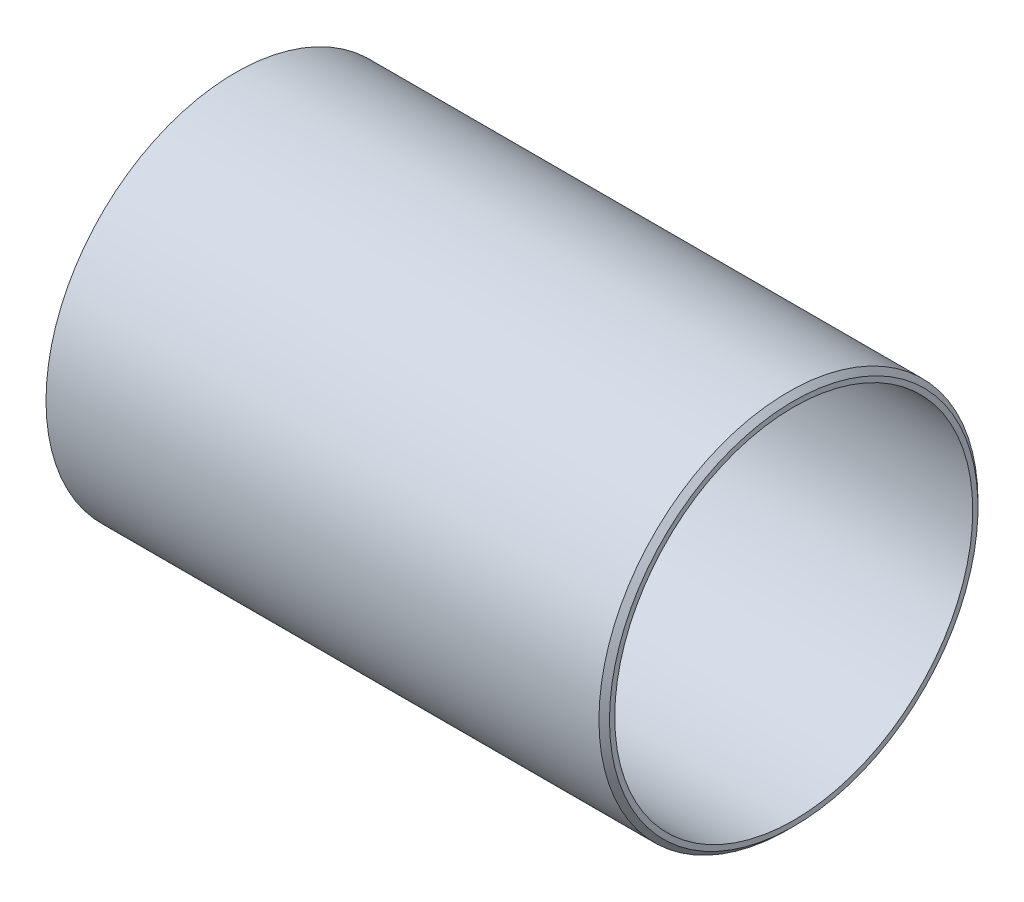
SolidWorks part; units mm, degrees
ref_plane "Front Plane" through (0, 0, 0) normal (0, 0, 1) x (1, 0, 0)
ref_plane "Top Plane" through (0, 0, 0) normal (0, 1, 0) x (1, 0, 0)
ref_plane "Right Plane" through (0, 0, 0) normal (1, 0, 0) x (0, 0, -1)
sketch "Sketch2" plane through (0, 0, 0) normal (-1, 0, 0) x (0, 1, 0)
  circle A0 centre (0, 0) radius 114.3
  circle A1 centre (0, 0) radius 107.95
  dimension "D1" = 228.6
  dimension "D2" = 6.35
extrude "Extrude2" add sketch "Sketch2" along normal offset from surface (336.65 mm away) 19.05
chamfer "Chamfer1" distance 3.175 angle 45
